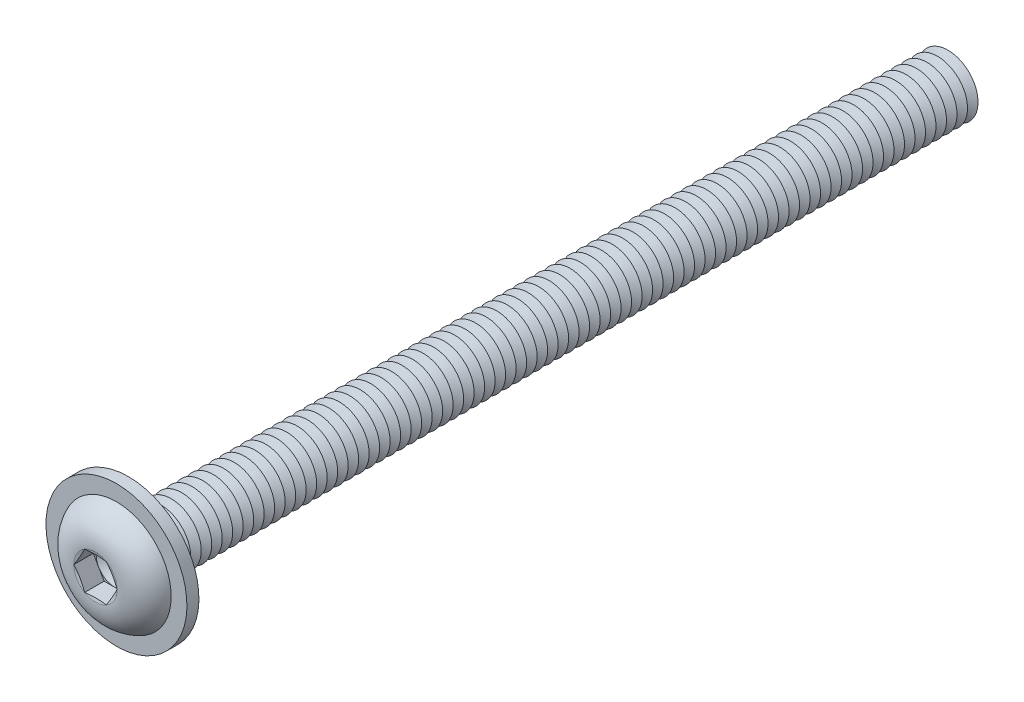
SolidWorks part; units mm, degrees
ref_plane "Front Plane" through (0, 0, 0) normal (0, 0, 1) x (1, 0, 0)
ref_plane "Top Plane" through (0, 0, 0) normal (0, 1, 0) x (1, 0, 0)
ref_plane "Right Plane" through (0, 0, 0) normal (1, 0, 0) x (0, 0, -1)
sketch "Sketch1" plane through (0, 0, 0) normal (1, 0, 0) x (0, 0, -1)
  line L0 (0, 2) -> (0, 3.8)
  line L3 (0, 2) -> (55, 2)
  line L4 (55, 2) -> (55, 0)
  line L5 (55, 0) -> (-2.2, 0) construction
  line L6 (-2.2, 0) -> (55, 0)
  line L7 (-2.2, 1.4434) -> (-2.2, 0.7217) construction
  line L8 (-2.2, 0.7217) -> (-2.2, 0)
  line L9 (-2.2, 1.4434) -> (-2.0066, 0.7217)
  line L10 (-2.0066, 0.7217) -> (-2.2, 0.7217)
  line L11 (55, 0) -> (22.7481, 0) construction
  line L12 (0, 3.8) -> (-2.2, 3.8) construction
  arc A1 (0, 3.8) -> (-2.2, 1.4434) centre (0, 1.5948) ccw
  point P8 (55, 1)
  dimension "D1" = 7.6
  dimension "D2" = 4
  dimension "D3" = 2.2
  dimension "D4" = 2.8868
  dimension "D5" = 55
  dimension "D6" = 15
revolve "Revolve1" add sketch "Sketch1" angle 360 about L5
fillet "Fillet1" radius 0.35 1 edges at (0, 2, 0)
sketch "Sketch2" plane through (0, 0, 0) normal (1, 0, 0) x (0, 0, -1)
  line L0 (54.65, 2) -> (55.35, 2)
  line L1 (55, 2) -> (0.35, 2) construction
  line L2 (55.35, 2) -> (55, 1.3938)
  line L3 (55, -2) -> (55, 2) construction
  line L4 (55, 1.3938) -> (54.65, 2)
  dimension "D1" = 0.7
revolve "Cut-Revolve1" cut sketch "Sketch2" angle 360 about axis through (0, 0, -55) along (0, 0, -1)
pattern_linear "LPattern1" count 78 spacing 0.7 along (0, 0, 1) of "Cut-Revolve1"
sketch "Sketch3" plane through (0, 0, 2.2) normal (0, 0, 1) x (1, 0, 0)
  line L7 (0.7217, 1.25) -> (-0.7217, 1.25)
  line L8 (-0.7217, 1.25) -> (-1.4434, 0)
  line L9 (-1.4434, 0) -> (-0.7217, -1.25)
  line L10 (-0.7217, -1.25) -> (0.7217, -1.25)
  line L11 (0.7217, -1.25) -> (1.4434, 0)
  line L12 (1.4434, 0) -> (0.7217, 1.25)
  circle A0 centre (0, 0) radius 1.25 construction
  circle A3 centre (0, 0) radius 1.4434 construction
extrude "Cut-Extrude1" cut sketch "Sketch3" against normal blind 1.3
sketch "Sketch4" plane through (0, 0, 0.9) normal (0, 0, 1) x (1, 0, 0)
  line L1 (0.7217, 1.25) -> (-0.7217, 1.25) construction
  circle A0 centre (0, 0) radius 1.25
extrude "Cut-Extrude2" cut sketch "Sketch4" against normal through all draft 60
sketch "Sketch5" plane through (0, 0, 0) normal (0, 0, -1) x (-1, 0, 0)
  circle A0 centre (0, 0) radius 4.7
  circle A1 centre (0, 0) radius 2.35
  circle A2 centre (0, 0) radius 2.35 construction
  dimension "D1" = 9.4
extrude "Boss-Extrude1" add sketch "Sketch5" against normal blind 0.8
